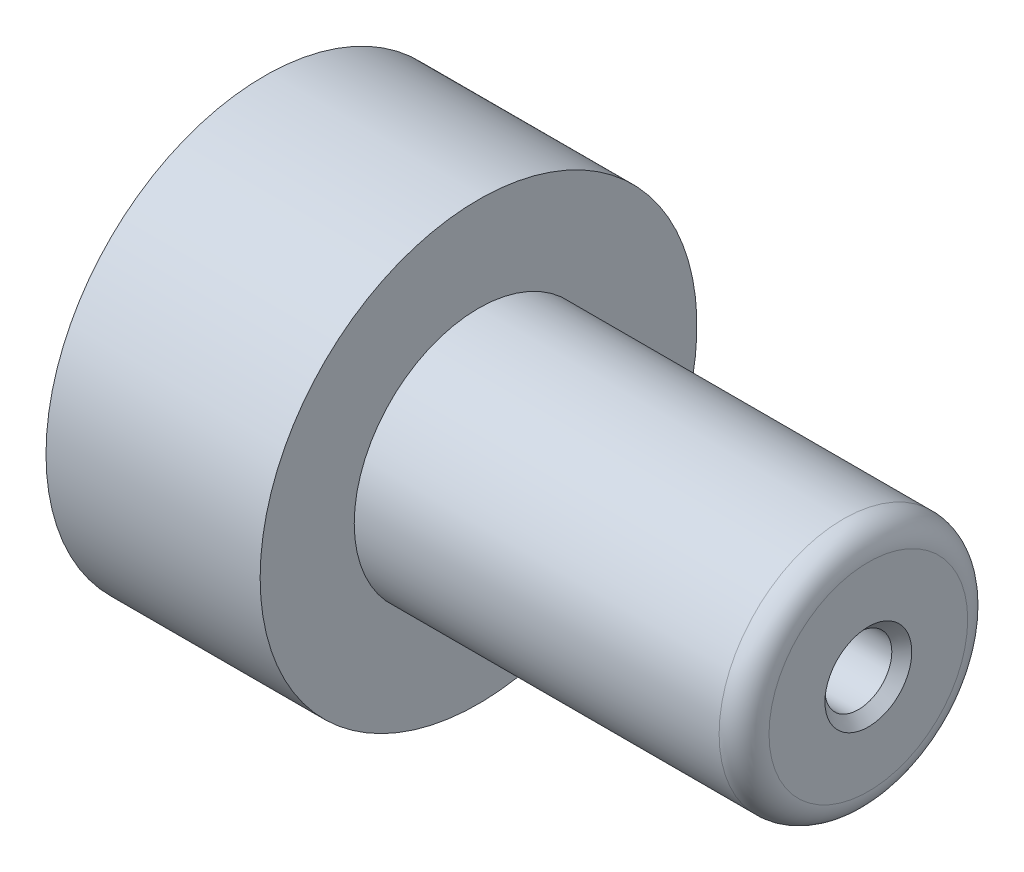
SolidWorks part; units mm, degrees
ref_plane "Front Plane" through (0, 0, 0) normal (0, 0, 1) x (1, 0, 0)
ref_plane "Top Plane" through (0, 0, 0) normal (0, 1, 0) x (1, 0, 0)
ref_plane "Right Plane" through (0, 0, 0) normal (1, 0, 0) x (0, 0, -1)
sketch "Sketch1" plane through (0, 0, 0) normal (0, 0, 1) x (1, 0, 0)
  line L0 (0, 0) -> (102.3864, 0) construction
  line L1 (0, 3.9751) -> (0, 11.1125)
  line L2 (0, 11.1125) -> (10.8966, 11.1125)
  line L3 (10.8966, 11.1125) -> (10.8966, 6.3246)
  line L4 (10.8966, 6.3246) -> (29.464, 6.3246)
  line L5 (30.734, 5.0546) -> (30.734, 0)
  line L6 (30.734, 0) -> (21.8948, 0)
  line L7 (0, 3.9751) -> (21.8948, 3.9751)
  line L8 (21.8948, 3.9751) -> (21.8948, 0)
  arc A0 (30.734, 5.0546) -> (29.464, 6.3246) centre (29.464, 5.0546) ccw
  dimension "D5" = 1.27
  dimension "D1" = 10.8966
  dimension "D2" = 22.225
  dimension "D3" = 21.8948
  dimension "D4" = 7.9502
  dimension "D6" = 30.734
  dimension "D7" = 12.6492
revolve "Revolve1" add sketch "Sketch1" angle 360 about L0
sketch "Sketch2" plane through (0, 0, 0) normal (-1, 0, 0) x (0, 0, 1)
  line L0 (0, 0) -> (0, 9.7644) construction
  circle A0 centre (-6.7437, 0) radius 1.2065
  circle A1 centre (6.7437, 0) radius 1.2065
  dimension "D2" = 2.413
  dimension "D1" = 13.4874
extrude "Cut-Extrude1" cut sketch "Sketch2" against normal blind 2.54
sketch "Sketch3" plane through (30.734, 0, 0) normal (1, 0, 0) x (0, 0, -1)
  circle A0 centre (0, 0) radius 1.7018
  dimension "D1" = 3.4036
extrude "Cut-Extrude2" cut sketch "Sketch3" against normal through all
chamfer "Chamfer1" distance 0.508 angle 45 1 edges at (30.734, 0, -1.7018)
